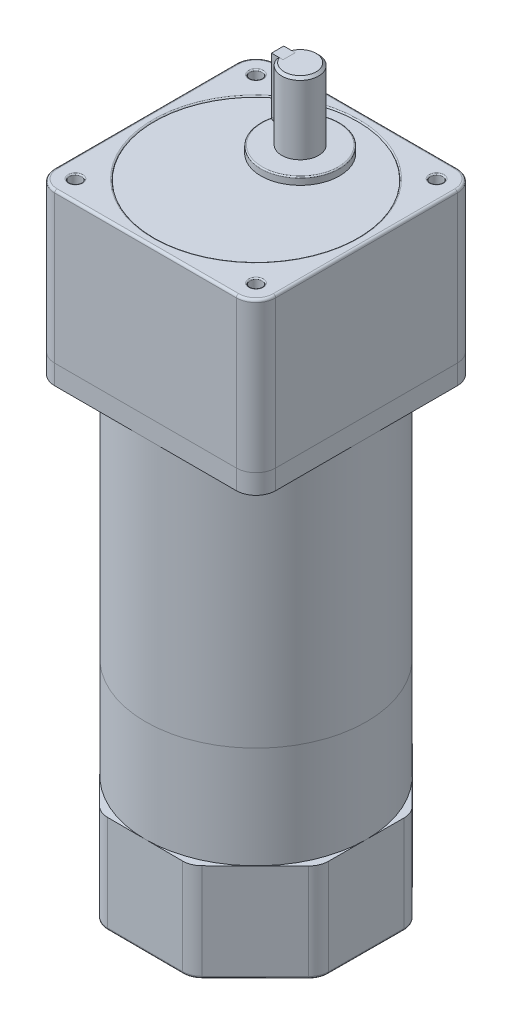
SolidWorks part; units mm, degrees
ref_plane "前视基准面" through (0, 0, 0) normal (0, 0, 1) x (1, 0, 0)
ref_plane "上视基准面" through (0, 0, 0) normal (0, 1, 0) x (1, 0, 0)
ref_plane "右视基准面" through (0, 0, 0) normal (1, 0, 0) x (0, 0, -1)
sketch "草图1" plane through (0, 0, 0) normal (0, 1, 0) x (1, 0, 0)
  line L1 (-37, -45) -> (37, -45)
  line L2 (-45, -37) -> (-45, 37)
  line L3 (-37, 45) -> (37, 45)
  line L4 (45, -37) -> (45, 37)
  line L5 (-45, -45) -> (45, 45) construction
  line L6 (-45, 45) -> (45, -45) construction
  arc A0 (-45, 37) -> (-37, 45) centre (-37, 37) cw
  arc A1 (-37, -45) -> (-45, -37) centre (-37, -37) cw
  arc A2 (37, 45) -> (45, 37) centre (37, 37) cw
  arc A3 (37, -45) -> (45, -37) centre (37, -37) ccw
  point P0 (0, 0)
  dimension "D1" = 8
extrude "凸台-拉伸1" add sketch "草图1" against normal blind 61
sketch "草图2" plane through (0, -61, 0) normal (0, -1, 0) x (1, 0, 0)
  line L0 (-37, 45) -> (37, 45) construction
  line L1 (-37, -45) -> (37, -45)
  line L2 (-45, -37) -> (-45, 37)
  line L3 (-37, 45) -> (37, 45)
  line L4 (45, -37) -> (45, 37)
  line L5 (-45, -45) -> (45, 45) construction
  line L6 (-45, 45) -> (45, -45) construction
  arc A0 (-37, -45) -> (-45, -37) centre (-37, -37) cw
  arc A1 (37, -45) -> (45, -37) centre (37, -37) ccw
  arc A2 (37, 45) -> (45, 37) centre (37, 37) cw
  arc A3 (-45, 37) -> (-37, 45) centre (-37, 37) cw
  point P0 (0, 0)
  dimension "D1" = 8
extrude "凸台-拉伸2" add sketch "草图2" along normal blind 8 separate body
sketch "草图3" plane through (0, -69, 0) normal (0, -1, 0) x (1, 0, 0)
  circle A0 centre (0, 0) radius 45
extrude "凸台-拉伸3" add sketch "草图3" along normal blind 100 separate body
sketch "草图4" plane through (0, -169, 0) normal (0, -1, 0) x (1, 0, 0)
  circle A0 centre (0, 0) radius 45
extrude "凸台-拉伸4" add sketch "草图4" along normal blind 41.5 separate body
sketch "草图5" plane through (0, -210.5, 0) normal (0, -1, 0) x (1, 0, 0)
  line L1 (15.1674, 45.0537) -> (-15.4843, 44.9458)
  line L2 (-21.1328, 42.5827) -> (-42.7305, 20.8324)
  line L3 (-45.0537, 15.1674) -> (-44.9458, -15.4843)
  line L4 (-42.5827, -21.1328) -> (-20.8324, -42.7305)
  line L5 (-15.1674, -45.0537) -> (15.4843, -44.9458)
  line L6 (21.1328, -42.5827) -> (42.7305, -20.8324)
  line L7 (45.0537, -15.1674) -> (44.9458, 15.4843)
  line L8 (42.5827, 21.1328) -> (20.8324, 42.7305)
  circle A0 centre (0, 0) radius 45 construction
  arc A1 (44.9458, 15.4843) -> (42.5827, 21.1328) centre (36.9458, 15.4561) ccw
  arc A2 (42.7305, -20.8324) -> (45.0537, -15.1674) centre (37.0537, -15.1955) ccw
  arc A3 (15.4843, -44.9458) -> (21.1328, -42.5827) centre (15.4561, -36.9458) ccw
  arc A4 (-20.8324, -42.7305) -> (-15.1674, -45.0537) centre (-15.1955, -37.0537) ccw
  arc A5 (-44.9458, -15.4843) -> (-42.5827, -21.1328) centre (-36.9458, -15.4561) ccw
  arc A6 (-42.7305, 20.8324) -> (-45.0537, 15.1674) centre (-37.0537, 15.1955) ccw
  arc A7 (15.1674, 45.0537) -> (20.8324, 42.7305) centre (15.1955, 37.0537) cw
  arc A8 (-15.4843, 44.9458) -> (-21.1328, 42.5827) centre (-15.4561, 36.9458) ccw
  dimension "D1" = 8
extrude "凸台-拉伸5" add sketch "草图5" along normal blind 40 separate body
fillet "圆角1" radius 1 16 edges at (44.9997, -250.5, 0.1584) (44.4555, -250.5, -18.231) (31.9316, -250.5, -31.7076) (18.5436, -250.5, -44.326) (0.1584, -250.5, -44.9997) (-18.231, -250.5, -44.4555) (-31.7076, -250.5, -31.9316) (-44.326, -250.5, -18.5436) (-44.9997, -250.5, -0.1584) (-44.4555, -250.5, 18.231) (-31.9316, -250.5, 31.7076) (-18.5436, -250.5, 44.326) (-0.1584, -250.5, 44.9997) (18.231, -250.5, 44.4555) (31.7076, -250.5, 31.9316) (44.326, -250.5, 18.5436)
fillet "圆角2" radius 1 8 edges at (0, 0, -45) (42.6569, 0, -42.6569) (45, 0, 0) (42.6569, 0, 42.6569) (0, 0, 45) (-42.6569, 0, 42.6569) (-45, 0, 0) (-42.6569, 0, -42.6569)
sketch "草图6" plane through (0, 0, 0) normal (0, 1, 0) x (1, 0, 0)
  point P19 (36.7696, -36.7696)
  point P20 (-36.7696, -36.7696)
  point P21 (-36.7696, 36.7696)
  point P22 (36.7696, 36.7696)
hole_wizard "M6 螺纹孔1" positions "3D草图1" profile "草图7" tap size "M6" standard "GB"
sketch3d "3D草图1"
  point P0 (36.7696, 0, 36.7696)
  point P3 (-36.7696, 0, 36.7696)
  point P6 (-36.7696, 0, -36.7696)
  point P9 (36.7696, 0, -36.7696)
sketch "草图7" plane through (36.7696, 0, 36.7696) normal (1, 0, 0) x (0, 0, 1)
  line L0 (0, 0) -> (0, 18.5022)
  line L1 (0, 18.5022) -> (2.5, 17)
  line L2 (2.5, 17) -> (2.5, 0)
  line L5 (2.5, 0) -> (0, 0)
  line L10 (0, 18.5022) -> (-2.5, 17) construction
  line L11 (0, -6.35) -> (0, 107.95) construction
  dimension "螺纹孔钻头直径" = 5
  dimension "螺纹孔钻头深度" = 17
  dimension "导头角度" = 118
sketch "草图8" plane through (0, -69, 0) normal (0, -1, 0) x (1, 0, 0)
  circle A1 centre (-36.7696, 36.7696) radius 3.5
  circle A2 centre (36.7696, 36.7696) radius 3.5
  circle A3 centre (36.7696, -36.7696) radius 3.5
  circle A4 centre (-36.7696, -36.7696) radius 3.5
extrude "切除-拉伸1" cut sketch "草图8" against normal blind 34
fillet "圆角3" radius 0.5 4 edges at (36.7696, 0, -34.2696) (-36.7696, 0, -34.2696) (-36.7696, 0, 39.2696) (36.7696, 0, 39.2696)
sketch "草图9" plane through (0, 0, 0) normal (0, 1, 0) x (1, 0, 0)
  circle A0 centre (0, 18) radius 16
extrude "凸台-拉伸6" add sketch "草图9" along normal blind 3 separate body
fillet "圆角4" radius 0.5 1 edges at (0, 3, -2)
sketch "草图10" plane through (0, 3, 0) normal (0, 1, 0) x (1, 0, 0)
  circle A0 centre (0, 18) radius 7.5
extrude "凸台-拉伸7" add sketch "草图10" along normal blind 29 separate body
sketch "草图11" plane through (0, 0, 0) normal (0, 1, 0) x (1, 0, 0)
  circle A0 centre (0, 0) radius 41.4
extrude "切除-拉伸2" cut sketch "草图11" against normal blind 0.5
fillet "圆角5" radius 0.5 1 edges at (0, 0, 41.4)
ref_plane "基准面2" through (-7.5, 0, 0) normal (1, 0, 0) x (0, 0, -1)
sketch "草图13" plane through (-7.5, 0, 0) normal (1, 0, 0) x (0, 0, -1)
  line L1 (25.5, 32) -> (10.5, 32) construction
  line L2 (20.5, 9.5) -> (20.5, 32)
  line L3 (20.5, 32) -> (15.5, 32)
  line L4 (15.5, 32) -> (15.5, 9.5)
  arc A0 (15.5, 9.5) -> (20.5, 9.5) centre (18, 9.5) ccw
extrude "切除-拉伸6" cut sketch "草图13" along normal blind 3
sketch "草图14" plane through (-4.5, 0, 0) normal (-1, 0, 0) x (0, 0, 1)
  line L0 (-20.5, 9.5) -> (-20.5, 32)
  line L1 (-20.5, 32) -> (-15.5, 32)
  line L2 (-15.5, 32) -> (-15.5, 9.5)
  arc A0 (-20.5, 9.5) -> (-15.5, 9.5) centre (-18, 9.5) ccw
extrude "凸台-拉伸8" add sketch "草图14" along normal blind 5 separate body
chamfer "倒角2" distance 0.3 angle 45 4 edges at (-9.5, 32, -18) (-9.5, 20.75, -20.5) (-9.5, 7, -18) (-9.5, 20.75, -15.5)
chamfer "倒角3" distance 1 angle 45 1 edges at (7.5, 32, -18)
